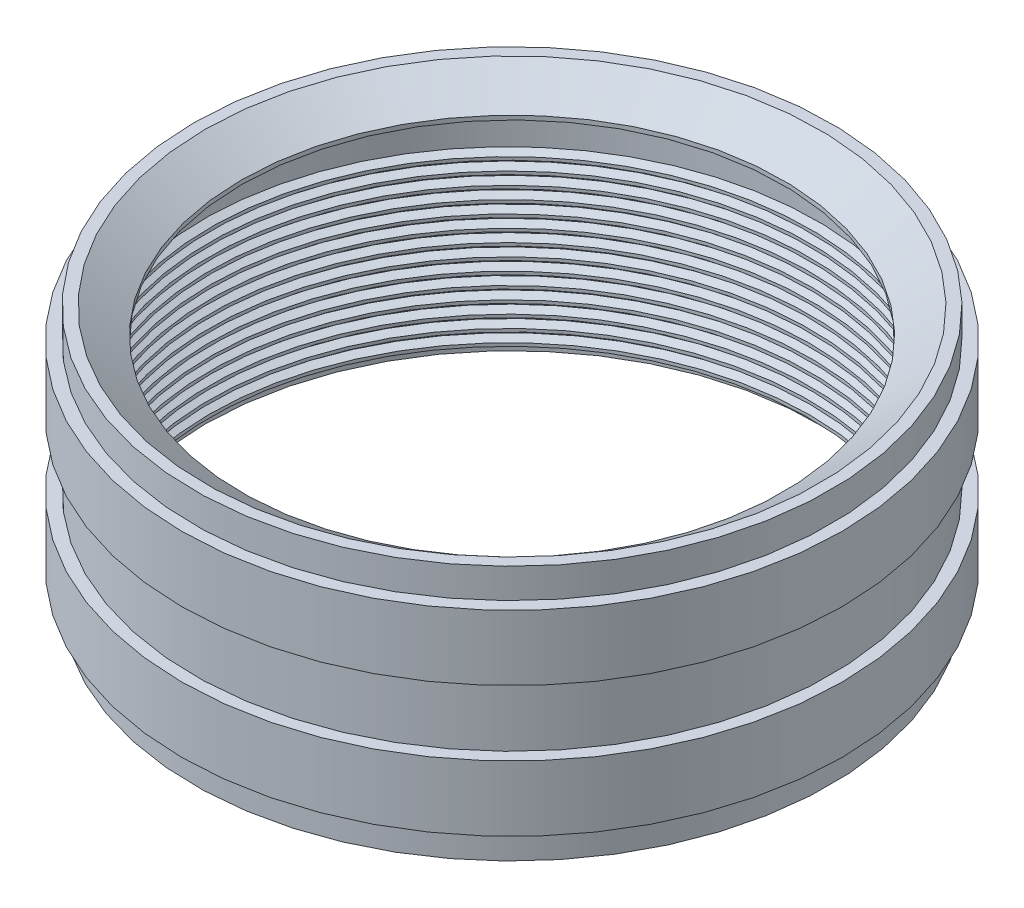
SolidWorks part; units mm, degrees
ref_plane "Frontal Plane" through (0, 0, 0) normal (0, 0, 1) x (1, 0, 0)
ref_plane "Horizontal Plane" through (0, 0, 0) normal (0, 1, 0) x (1, 0, 0)
ref_plane "Profile Plane" through (0, 0, 0) normal (1, 0, 0) x (0, 0, -1)
sketch "Sketch1" plane through (0, 0, 0) normal (0, 0, 1) x (1, 0, 0)
  line L1 (-4.064, 0) -> (-4.064, -2.54)
  line L2 (-4.064, -2.54) -> (-5.08, -2.54)
  line L3 (-5.08, -2.54) -> (-5.08, -8.1111)
  line L4 (-5.08, -8.1111) -> (-4.064, -8.1111)
  line L5 (-4.064, -8.1111) -> (-4.064, -13.6821)
  line L6 (-4.064, -13.6821) -> (-5.08, -13.6821)
  line L7 (-5.08, -13.6821) -> (-5.08, -19.2532)
  line L8 (-5.08, -19.2532) -> (-4.064, -19.2532)
  line L9 (-4.064, -19.2532) -> (-4.064, -21.7932)
  line L10 (-4.064, -21.7932) -> (-3.0988, -21.7932)
  line L12 (-3.0988, -21.7932) -> (-3.0988, -2.54)
  line L13 (-3.0988, -2.54) -> (0, -2.54)
  line L15 (23.1013, 0) -> (23.1013, -21.7932) construction
  line L16 (0, -2.54) -> (0, -2.1899)
  line L17 (-4.064, 0) -> (-3.0988, 0)
  line L18 (-3.0988, 0) -> (0, -2.1899)
  dimension "D1" = 4.064
  dimension "D2" = 5.08
  dimension "D3" = 2.54
  dimension "D4" = 8.1111
  dimension "D5" = 2.54
  dimension "D6" = 0.9652
  dimension "D7" = 19.2532
  dimension "D8" = 27.1653
  dimension "D9" = 3.0988
  dimension "D10" = 2.1899
revolve "Revolve1" add sketch "Sketch1" angle 360 about L15
thread "Thread1" pitch 1.0583 start angle 0, offset 0, length 0, pitch 1.0583, diameter 52.4002
ref_plane "Plane1" through (49.3014, -21.7932, 0) normal (0, 0, 1) x (1, 0, 0)
sketch "Thread Profile1" plane through (49.3014, -21.7932, 0) normal (0, 0, 1) x (1, 0, 0)
  line L0 (0, 0) -> (0, 1.0583) construction
  line L11 (0, 0) -> (0, 0.926)
  line L12 (0, 0.926) -> (-0.5728, 0.5953)
  line L13 (-0.5728, 0.5953) -> (-0.5728, 0.3307)
  line L15 (-0.5728, 0.3307) -> (0, 0)
  line L17 (-0.5728, 0.463) -> (0, 0.463) construction
  point P2 (0, 0)
  dimension "Pitch" = 1.0583
  dimension "Profile_Angle" = 60
  dimension "Profile_Land" = 0.2646
  dimension "Profile_Height" = 0.5728
